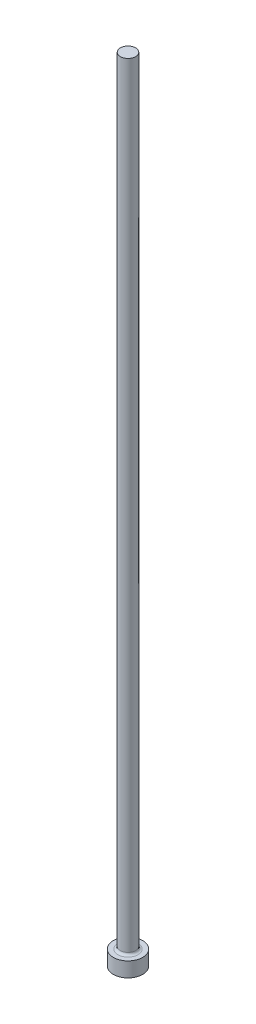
SolidWorks part; units mm, degrees
ref_plane "Front Plane" through (0, 0, 0) normal (0, 0, 1) x (1, 0, 0)
ref_plane "Top Plane" through (0, 0, 0) normal (0, 1, 0) x (1, 0, 0)
ref_plane "Right Plane" through (0, 0, 0) normal (1, 0, 0) x (0, 0, -1)
sketch "Sketch1" plane through (0, 0, 0) normal (0, 0, 1) x (1, 0, 0)
  line L0 (0, 0) -> (4.699, 0)
  line L1 (55, 0) -> (-55, 0) construction
  line L2 (4.699, 0) -> (4.699, 4.7498)
  line L3 (4.699, 4.7498) -> (3.2067, 4.7498)
  line L4 (2.4447, 5.5118) -> (2.4447, 254)
  line L5 (2.4447, 254) -> (0, 254)
  line L6 (0, 254) -> (0, 0)
  arc A0 (3.2067, 4.7498) -> (2.4447, 5.5118) centre (3.2067, 5.5118) cw
  dimension "D5" = 0.762
  dimension "D1" = 2.4447
  dimension "D2" = 4.699
  dimension "D3" = 4.7498
  dimension "D4" = 254
revolve "Revolve1" add sketch "Sketch1" angle 360 about L6
